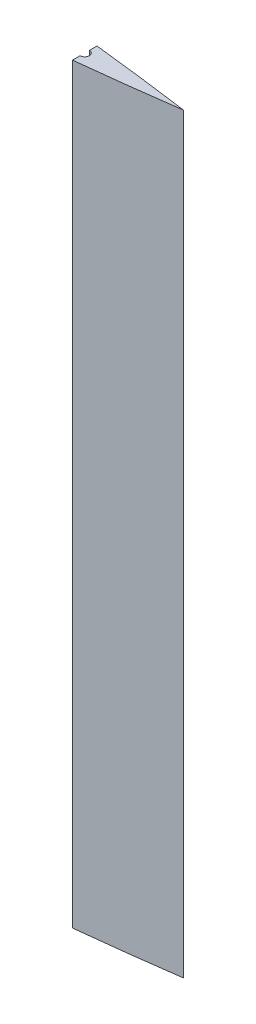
SolidWorks part; units mm, degrees
ref_plane "Front Plane" through (0, 0, 0) normal (0, 0, 1) x (1, 0, 0)
ref_plane "Top Plane" through (0, 0, 0) normal (0, 1, 0) x (1, 0, 0)
ref_plane "Right Plane" through (0, 0, 0) normal (1, 0, 0) x (0, 0, -1)
sketch "Sketch1" plane through (0, 0, 0) normal (0, 1, 0) x (1, 0, 0)
  line L0 (67.779, 0.1312) -> (67.7979, 0.1196)
  spline S0 degree 3 poles (67.779, 0.1312) (65.037, 0.509) (59.9653, 1.2133) (52.5545, 2.1584) (45.5544, 3.0065) (36.2239, 4.0688) (26.8903, 5.0418) (17.554, 5.9194) (10.5538, 6.5213) (3.5539, 7.068) (-3.4928, 7.5501) (-10.5393, 7.9627) (-17.5866, 8.2682) (-24.587, 8.4939) (-30.3757, 8.4899) (-34.995, 8.5975) (-40.7818, 8.6781) (-47.7881, 8.6816) (-54.7938, 8.3117) (-59.2263, 7.8182) (-62.2657, 7.3199) (-64.6009, 6.7884) (-66.462, 6.2257) (-67.8707, 5.7109) (-69.2876, 5.0653) (-70.7297, 4.2194) (-71.9259, 3.2301) (-72.9794, 1.9059) (-73.7548, 0.1241) (-72.9794, -1.6577) (-71.9259, -2.9819) (-70.7297, -3.9712) (-69.2876, -4.8171) (-67.8707, -5.4627) (-66.462, -5.9775) (-64.6009, -6.5402) (-62.2657, -7.0717) (-59.2263, -7.57) (-54.7938, -8.0635) (-47.7881, -8.4334) (-40.7818, -8.4299) (-34.995, -8.3493) (-30.3757, -8.2417) (-24.587, -8.2457) (-17.5866, -8.02) (-10.5393, -7.7145) (-3.4928, -7.3019) (3.5539, -6.8198) (10.5538, -6.2731) (17.554, -5.6712) (26.8903, -4.7936) (36.2239, -3.8206) (45.5544, -2.7583) (52.5545, -1.9102) (59.9716, -0.9642) (65.0496, -0.2591) (67.7979, 0.1196) knots -0.004321 -0.004321 -0.004321 -0.004321 0.024634 0.049243 0.07383 0.098397 0.147479 0.171995 0.196494 0.220976 0.245442 0.27038 0.294813 0.319232 0.343642 0.35536 0.367566 0.404183 0.428636 0.44092 0.450818 0.460843 0.465946 0.471149 0.476523 0.482208 0.488618 0.492568 0.5 0.507432 0.511382 0.517792 0.523477 0.528851 0.534054 0.539157 0.549182 0.55908 0.571364 0.595817 0.632434 0.64464 0.656358 0.680768 0.705187 0.72962 0.754558 0.779024 0.803506 0.828005 0.852521 0.901603 0.92617 0.950757 0.975366 1.004387 1.004387 1.004387 1.004387
  point P2 (67.779, 0.1312)
extrude "Boss-Extrude1" add sketch "Sketch1" along normal blind 3.175
sketch "Sketch2" plane through (0, 3.175, 0) normal (0, 1, 0) x (1, 0, 0)
  line L0 (67.779, 0.1312) -> (-73.4485, 0.1312) construction
  circle A0 centre (35.779, 0.1312) radius 1.5
  spline S0 degree 3 poles (67.779, 0.1312) (65.037, 0.509) (59.9653, 1.2133) (52.5545, 2.1584) (45.5544, 3.0065) (36.2239, 4.0688) (26.8903, 5.0418) (17.554, 5.9194) (10.5538, 6.5213) (3.5539, 7.068) (-3.4928, 7.5501) (-10.5393, 7.9627) (-17.5866, 8.2682) (-24.587, 8.4939) (-30.3757, 8.4899) (-34.995, 8.5975) (-40.7818, 8.6781) (-47.7881, 8.6816) (-54.7938, 8.3117) (-59.2263, 7.8182) (-62.2657, 7.3199) (-64.6009, 6.7884) (-66.462, 6.2257) (-67.8707, 5.7109) (-69.2876, 5.0653) (-70.7297, 4.2194) (-71.9259, 3.2301) (-72.9794, 1.9059) (-73.7548, 0.1241) (-72.9794, -1.6577) (-71.9259, -2.9819) (-70.7297, -3.9712) (-69.2876, -4.8171) (-67.8707, -5.4627) (-66.462, -5.9775) (-64.6009, -6.5402) (-62.2657, -7.0717) (-59.2263, -7.57) (-54.7938, -8.0635) (-47.7881, -8.4334) (-40.7818, -8.4299) (-34.995, -8.3493) (-30.3757, -8.2417) (-24.587, -8.2457) (-17.5866, -8.02) (-10.5393, -7.7145) (-3.4928, -7.3019) (3.5539, -6.8198) (10.5538, -6.2731) (17.554, -5.6712) (26.8903, -4.7936) (36.2239, -3.8206) (45.5544, -2.7583) (52.5545, -1.9102) (59.9716, -0.9642) (65.0496, -0.2591) (67.7979, 0.1196) knots -0.004321 -0.004321 -0.004321 -0.004321 0.024634 0.049243 0.07383 0.098397 0.147479 0.171995 0.196494 0.220976 0.245442 0.27038 0.294813 0.319232 0.343642 0.35536 0.367566 0.404183 0.428636 0.44092 0.450818 0.460843 0.465946 0.471149 0.476523 0.482208 0.488618 0.492568 0.5 0.507432 0.511382 0.517792 0.523477 0.528851 0.534054 0.539157 0.549182 0.55908 0.571364 0.595817 0.632434 0.64464 0.656358 0.680768 0.705187 0.72962 0.754558 0.779024 0.803506 0.828005 0.852521 0.901603 0.92617 0.950757 0.975366 1.004387 1.004387 1.004387 1.004387 construction
  dimension "D1" = 3
  dimension "D2" = 32
extrude "Cut-Extrude1" cut sketch "Sketch2" against normal blind 3.175
sketch "Sketch3" plane through (0, 0, 0) normal (0, -1, 0) x (1, 0, 0)
  line L0 (67.7979, -0.1196) -> (-73.4485, -0.1196) construction
  circle A0 centre (-52.1985, -0.1196) radius 1.5
  spline S0 degree 3 poles (67.779, -0.1312) (65.037, -0.509) (59.9653, -1.2133) (52.5545, -2.1584) (45.5544, -3.0065) (36.2239, -4.0688) (26.8903, -5.0418) (17.554, -5.9194) (10.5538, -6.5213) (3.5539, -7.068) (-3.4928, -7.5501) (-10.5393, -7.9627) (-17.5866, -8.2682) (-24.587, -8.4939) (-30.3757, -8.4899) (-34.995, -8.5975) (-40.7818, -8.6781) (-47.7881, -8.6816) (-54.7938, -8.3117) (-59.2263, -7.8182) (-62.2657, -7.3199) (-64.6009, -6.7884) (-66.462, -6.2257) (-67.8707, -5.7109) (-69.2876, -5.0653) (-70.7297, -4.2194) (-71.9259, -3.2301) (-72.9794, -1.9059) (-73.7548, -0.1241) (-72.9794, 1.6577) (-71.9259, 2.9819) (-70.7297, 3.9712) (-69.2876, 4.8171) (-67.8707, 5.4627) (-66.462, 5.9775) (-64.6009, 6.5402) (-62.2657, 7.0717) (-59.2263, 7.57) (-54.7938, 8.0635) (-47.7881, 8.4334) (-40.7818, 8.4299) (-34.995, 8.3493) (-30.3757, 8.2417) (-24.587, 8.2457) (-17.5866, 8.02) (-10.5393, 7.7145) (-3.4928, 7.3019) (3.5539, 6.8198) (10.5538, 6.2731) (17.554, 5.6712) (26.8903, 4.7936) (36.2239, 3.8206) (45.5544, 2.7583) (52.5545, 1.9102) (59.9716, 0.9642) (65.0496, 0.2591) (67.7979, -0.1196) knots -0.004321 -0.004321 -0.004321 -0.004321 0.024634 0.049243 0.07383 0.098397 0.147479 0.171995 0.196494 0.220976 0.245442 0.27038 0.294813 0.319232 0.343642 0.35536 0.367566 0.404183 0.428636 0.44092 0.450818 0.460843 0.465946 0.471149 0.476523 0.482208 0.488618 0.492568 0.5 0.507432 0.511382 0.517792 0.523477 0.528851 0.534054 0.539157 0.549182 0.55908 0.571364 0.595817 0.632434 0.64464 0.656358 0.680768 0.705187 0.72962 0.754558 0.779024 0.803506 0.828005 0.852521 0.901603 0.92617 0.950757 0.975366 1.004387 1.004387 1.004387 1.004387 construction
  dimension "D2" = 3
  dimension "D1" = 21.25
extrude "Cut-Extrude2" cut sketch "Sketch3" against normal blind 1.5875
sketch "Sketch4" plane through (0, 3.175, 0) normal (0, 1, 0) x (1, 0, 0)
  line L0 (35.779, 4.0996) -> (35.779, 1.6312)
  line L1 (35.779, -1.3688) -> (35.779, -3.8514)
  line L2 (67.7979, 0.1196) -> (67.779, 0.1312)
  line L3 (67.7979, 0.1196) -> (67.779, 0.1312)
  circle A1 centre (35.779, 0.1312) radius 1.5
  arc A2 (35.779, -1.3688) -> (35.779, 1.6312) centre (35.779, 0.1312) ccw
  spline S0 degree 3 poles (67.779, 0.1312) (65.037, 0.509) (59.9653, 1.2133) (52.5545, 2.1584) (45.5544, 3.0065) (36.2239, 4.0688) (26.8903, 5.0418) (17.554, 5.9194) (10.5538, 6.5213) (3.5539, 7.068) (-3.4928, 7.5501) (-10.5393, 7.9627) (-17.5866, 8.2682) (-24.587, 8.4939) (-30.3757, 8.4899) (-34.995, 8.5975) (-40.7818, 8.6781) (-47.7881, 8.6816) (-54.7938, 8.3117) (-59.2263, 7.8182) (-62.2657, 7.3199) (-64.6009, 6.7884) (-66.462, 6.2257) (-67.8707, 5.7109) (-69.2876, 5.0653) (-70.7297, 4.2194) (-71.9259, 3.2301) (-72.9794, 1.9059) (-73.7548, 0.1241) (-72.9794, -1.6577) (-71.9259, -2.9819) (-70.7297, -3.9712) (-69.2876, -4.8171) (-67.8707, -5.4627) (-66.462, -5.9775) (-64.6009, -6.5402) (-62.2657, -7.0717) (-59.2263, -7.57) (-54.7938, -8.0635) (-47.7881, -8.4334) (-40.7818, -8.4299) (-34.995, -8.3493) (-30.3757, -8.2417) (-24.587, -8.2457) (-17.5866, -8.02) (-10.5393, -7.7145) (-3.4928, -7.3019) (3.5539, -6.8198) (10.5538, -6.2731) (17.554, -5.6712) (26.8903, -4.7936) (36.2239, -3.8206) (45.5544, -2.7583) (52.5545, -1.9102) (59.9716, -0.9642) (65.0496, -0.2591) (67.7979, 0.1196) knots -0.004321 -0.004321 -0.004321 -0.004321 0.024634 0.049243 0.07383 0.098397 0.147479 0.171995 0.196494 0.220976 0.245442 0.27038 0.294813 0.319232 0.343642 0.35536 0.367566 0.404183 0.428636 0.44092 0.450818 0.460843 0.465946 0.471149 0.476523 0.482208 0.488618 0.492568 0.5 0.507432 0.511382 0.517792 0.523477 0.528851 0.534054 0.539157 0.549182 0.55908 0.571364 0.595817 0.632434 0.64464 0.656358 0.680768 0.705187 0.72962 0.754558 0.779024 0.803506 0.828005 0.852521 0.901603 0.92617 0.950757 0.975366 1.004387 1.004387 1.004387 1.004387 construction
  spline S1 degree 3 poles (35.779, -3.8514) (36.7033, -3.7515) (39.962, -3.395) (45.5544, -2.7583) (52.5545, -1.9102) (59.9716, -0.9642) (65.0496, -0.2591) (67.7979, 0.1196) knots 0.891878 0.891878 0.891878 0.891878 0.901603 0.92617 0.950757 0.975366 1.004387 1.004387 1.004387 1.004387
  spline S2 degree 3 poles (1242.3312, 4833.5365) (402.2604, -113.1996) (233.222, -20.8828) (52.5545, 2.1584) (45.5544, 3.0065) (36.2239, 4.0688) (26.8903, 5.0418) (17.554, 5.9194) (10.5538, 6.5213) (3.5539, 7.068) (-3.4928, 7.5501) (-10.5393, 7.9627) (-17.5866, 8.2682) (-24.587, 8.4939) (-30.3757, 8.4899) (-34.995, 8.5975) (-40.7818, 8.6781) (-47.7881, 8.6816) (-54.7938, 8.3117) (-59.2263, 7.8182) (-62.2657, 7.3199) (-64.6009, 6.7884) (-66.462, 6.2257) (-67.8707, 5.7109) (-69.2876, 5.0653) (-70.7297, 4.2194) (-71.9259, 3.2301) (-72.9794, 1.9059) (-73.7548, 0.1241) (-72.9794, -1.6577) (-71.9259, -2.9819) (-70.7297, -3.9712) (-69.2876, -4.8171) (-67.8707, -5.4627) (-66.462, -5.9775) (-64.6009, -6.5402) (-62.2657, -7.0717) (-59.2263, -7.57) (-54.7938, -8.0635) (-47.7881, -8.4334) (-40.7818, -8.4299) (-34.995, -8.3493) (-30.3757, -8.2417) (-24.587, -8.2457) (-17.5866, -8.02) (-10.5393, -7.7145) (-3.4928, -7.3019) (3.5539, -6.8198) (10.5538, -6.2731) (17.554, -5.6712) (26.8903, -4.7936) (36.2239, -3.8206) (45.5544, -2.7583) (52.5545, -1.9102) (233.2204, 21.1308) (402.2574, 113.4462) (1242.3088, -4833.156) knots -1.831403 -1.831403 -1.831403 -1.831403 0.024634 0.049243 0.07383 0.098397 0.147479 0.171995 0.196494 0.220976 0.245442 0.27038 0.294813 0.319232 0.343642 0.35536 0.367566 0.404183 0.428636 0.44092 0.450818 0.460843 0.465946 0.471149 0.476523 0.482208 0.488618 0.492568 0.5 0.507432 0.511382 0.517792 0.523477 0.528851 0.534054 0.539157 0.549182 0.55908 0.571364 0.595817 0.632434 0.64464 0.656358 0.680768 0.705187 0.72962 0.754558 0.779024 0.803506 0.828005 0.852521 0.901603 0.92617 0.950757 0.975366 2.831386 2.831386 2.831386 2.831386 only from (67.779, 0.1312) to (67.7979, 0.1196)
  spline S3 degree 3 poles (67.779, 0.1312) (65.037, 0.509) (59.9653, 1.2133) (52.5545, 2.1584) (45.5544, 3.0065) (39.962, 3.6432) (36.7033, 3.9997) (35.779, 4.0996) knots -0.004321 -0.004321 -0.004321 -0.004321 0.024634 0.049243 0.07383 0.098397 0.108122 0.108122 0.108122 0.108122
  dimension "D1" = 0
  dimension "D2" = 0
extrude "Cut-Extrude3" cut sketch "Sketch4" against normal through all both and the other way through all
sketch "Sketch5" plane through (0, 0, 0) normal (0, 1, 0) x (1, 0, 0)
  line L0 (67.7979, 0.1196) -> (67.8309, 0.1241)
  line L1 (67.779, 0.1312) -> (67.8309, 0.1241)
  line L2 (35.779, 4.0996) -> (35.779, 1.6312)
  line L3 (35.779, -1.3688) -> (35.779, -3.8514)
  arc A2 (35.779, -1.3688) -> (35.779, 1.6312) centre (35.779, 0.1312) ccw
  spline S1 degree 3 poles (67.779, 0.1312) (65.037, 0.509) (59.9653, 1.2133) (52.5545, 2.1584) (45.5544, 3.0065) (39.962, 3.6432) (36.7033, 3.9997) (35.779, 4.0996) knots -0.004321 -0.004321 -0.004321 -0.004321 0.024634 0.049243 0.07383 0.098397 0.108122 0.108122 0.108122 0.108122
  spline S2 degree 3 poles (35.779, -3.8514) (36.7033, -3.7515) (39.962, -3.395) (45.5544, -2.7583) (52.5545, -1.9102) (59.9716, -0.9642) (65.0496, -0.2591) (67.7979, 0.1196) knots 0.891878 0.891878 0.891878 0.891878 0.901603 0.92617 0.950757 0.975366 1.004387 1.004387 1.004387 1.004387
extrude "Boss-Extrude2" add sketch "Sketch5" along normal blind 244 contours L3 S2 L0 L1 S1 L2 A2
sketch "Sketch6" plane through (0, 3.175, 0) normal (0, 1, 0) x (1, 0, 0)
  line L2 (35.779, -3.8514) -> (35.779, -1.3688)
  line L3 (35.779, 1.6312) -> (35.779, 4.0996)
  line L4 (35.779, -3.8514) -> (35.779, -1.3688)
  line L5 (35.779, 1.6312) -> (35.779, 4.0996)
  arc A1 (35.779, 1.6312) -> (35.779, -1.3688) centre (35.779, 0.1312) ccw
  arc A2 (35.779, 1.6312) -> (35.779, -1.3688) centre (35.779, 0.1312) ccw
  spline S1 degree 3 poles (1338.8466, 3291.5527) (1232.6338, -697.7395) (654.8458, -53.9844) (17.5539, 5.9195) (10.5537, 6.5213) (3.5537, 7.0681) (-3.4931, 7.5502) (-10.5396, 7.9628) (-17.5869, 8.2682) (-24.5874, 8.4939) (-30.3761, 8.49) (-34.9954, 8.5976) (-40.7823, 8.6782) (-47.7887, 8.6817) (-54.7944, 8.3117) (-59.2269, 7.8183) (-62.2663, 7.3199) (-64.6016, 6.7885) (-66.4627, 6.2258) (-67.8714, 5.7109) (-69.2883, 5.0653) (-70.7304, 4.2194) (-71.9266, 3.2301) (-72.9801, 1.9059) (-73.7555, 0.1241) (-72.9801, -1.6577) (-71.9266, -2.9819) (-70.7304, -3.9712) (-69.2883, -4.8171) (-67.8714, -5.4627) (-66.4627, -5.9776) (-64.6016, -6.5403) (-62.2663, -7.0717) (-59.2269, -7.5701) (-54.7944, -8.0635) (-47.7887, -8.4335) (-40.7823, -8.43) (-34.9954, -8.3494) (-30.3761, -8.2418) (-24.5874, -8.2457) (-17.5869, -8.02) (-10.5396, -7.7146) (-3.4931, -7.302) (3.5537, -6.8199) (10.5537, -6.2731) (17.5539, -5.6713) (654.8395, 54.232) (1232.6223, 697.9748) (1338.8434, -3291.1849) knots -6.499463 -6.499463 -6.499463 -6.499463 0.147479 0.171995 0.196494 0.220976 0.245442 0.27038 0.294813 0.319232 0.343642 0.35536 0.367566 0.404183 0.428636 0.44092 0.450818 0.460843 0.465946 0.471149 0.476523 0.482208 0.488618 0.492568 0.5 0.507432 0.511382 0.517792 0.523477 0.528851 0.534054 0.539157 0.549182 0.55908 0.571364 0.595817 0.632434 0.64464 0.656358 0.680768 0.705187 0.72962 0.754558 0.779024 0.803506 0.828005 0.852521 7.499396 7.499396 7.499396 7.499396 only from (35.779, 4.0996) to (35.779, -3.8514)
  spline S2 degree 3 poles (35.779, 4.0996) (32.0386, 4.5039) (25.9647, 5.1289) (17.5539, 5.9195) (10.5537, 6.5213) (3.5537, 7.0681) (-3.4931, 7.5502) (-10.5396, 7.9628) (-17.5869, 8.2682) (-24.5874, 8.4939) (-30.3761, 8.49) (-34.9954, 8.5976) (-40.7823, 8.6782) (-47.7887, 8.6817) (-54.7944, 8.3117) (-59.2269, 7.8183) (-62.2663, 7.3199) (-64.6016, 6.7885) (-66.4627, 6.2258) (-67.8714, 5.7109) (-69.2883, 5.0653) (-70.7304, 4.2194) (-71.9266, 3.2301) (-72.9801, 1.9059) (-73.7555, 0.1241) (-72.9801, -1.6577) (-71.9266, -2.9819) (-70.7304, -3.9712) (-69.2883, -4.8171) (-67.8714, -5.4627) (-66.4627, -5.9776) (-64.6016, -6.5403) (-62.2663, -7.0717) (-59.2269, -7.5701) (-54.7944, -8.0635) (-47.7887, -8.4335) (-40.7823, -8.43) (-34.9954, -8.3494) (-30.3761, -8.2418) (-24.5874, -8.2457) (-17.5869, -8.02) (-10.5396, -7.7146) (-3.4931, -7.302) (3.5537, -6.8199) (10.5537, -6.2731) (17.5539, -5.6713) (25.9647, -4.8807) (32.0386, -4.2557) (35.779, -3.8514) knots 0.108122 0.108122 0.108122 0.108122 0.147479 0.171995 0.196494 0.220976 0.245442 0.27038 0.294813 0.319232 0.343642 0.35536 0.367566 0.404183 0.428636 0.44092 0.450818 0.460843 0.465946 0.471149 0.476523 0.482208 0.488618 0.492568 0.5 0.507432 0.511382 0.517792 0.523477 0.528851 0.534054 0.539157 0.549182 0.55908 0.571364 0.595817 0.632434 0.64464 0.656358 0.680768 0.705187 0.72962 0.754558 0.779024 0.803506 0.828005 0.852521 0.891878 0.891878 0.891878 0.891878
  dimension "D1" = 0
extrude "Cut-Extrude4" cut sketch "Sketch6" against normal through all both and the other way through all
